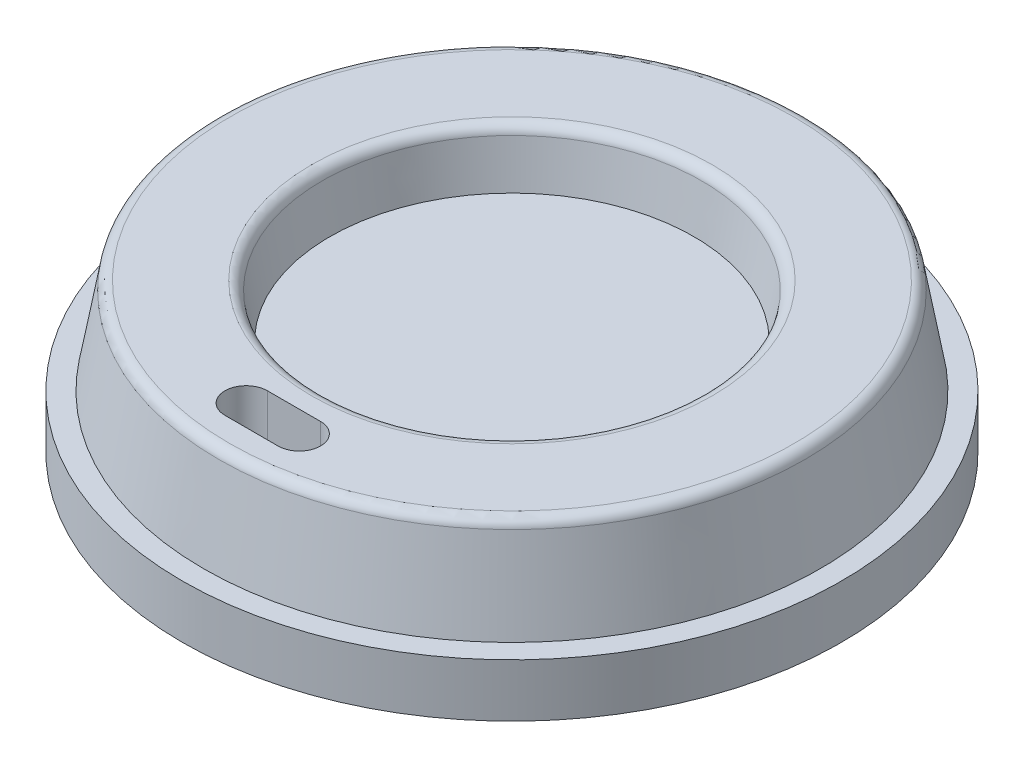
SolidWorks part; units mm, degrees
ref_plane "Front Plane" through (0, 0, 0) normal (0, 0, 1) x (1, 0, 0)
ref_plane "Top Plane" through (0, 0, 0) normal (0, 1, 0) x (1, 0, 0)
ref_plane "Right Plane" through (0, 0, 0) normal (1, 0, 0) x (0, 0, -1)
sketch "Sketch1" plane through (0, 0, 0) normal (0, 1, 0) x (1, 0, 0)
  circle A0 centre (0, 0) radius 23
  dimension "D1" = 46
extrude "Boss-Extrude1" add sketch "Sketch1" along normal blind 5
sketch "Sketch2" plane through (0, 5, 0) normal (0, 1, 0) x (1, 0, 0)
  circle A0 centre (0, 0) radius 31
  dimension "D1" = 62
extrude "Boss-Extrude2" add sketch "Sketch2" along normal blind 5
sketch "Sketch3" plane through (0, 10, 0) normal (0, 1, 0) x (1, 0, 0)
  circle A0 centre (0, 0) radius 29
  dimension "D1" = 58
extrude "Boss-Extrude3" add sketch "Sketch3" along normal blind 9 draft 10
fillet "Fillet1" radius 1 1 edges at (0, 19, 27.4131)
sketch "Sketch5" plane through (0, 19, 0) normal (0, 1, 0) x (1, 0, 0)
  circle A0 centre (0, 0) radius 18
  dimension "D1" = 36
extrude "Cut-Extrude1" cut sketch "Sketch5" against normal blind 5 draft 10
fillet "Fillet2" radius 1 1 edges at (0, 19, 18)
sketch "Sketch6" plane through (0, 19, 0) normal (0, 1, 0) x (1, 0, 0)
  line L0 (-2.5, -22.5) -> (2.5, -22.5) construction
  line L1 (-2.5, -20.5) -> (2.5, -20.5)
  line L2 (-2.5, -24.5) -> (2.5, -24.5)
  arc A0 (-2.5, -20.5) -> (-2.5, -24.5) centre (-2.5, -22.5) ccw
  arc A1 (2.5, -24.5) -> (2.5, -20.5) centre (2.5, -22.5) ccw
  point P2 (0, -22.5)
  dimension "D2" = 9
  dimension "D1" = 22.5
  dimension "D3" = 4
extrude "Cut-Extrude2" cut sketch "Sketch6" against normal through all
